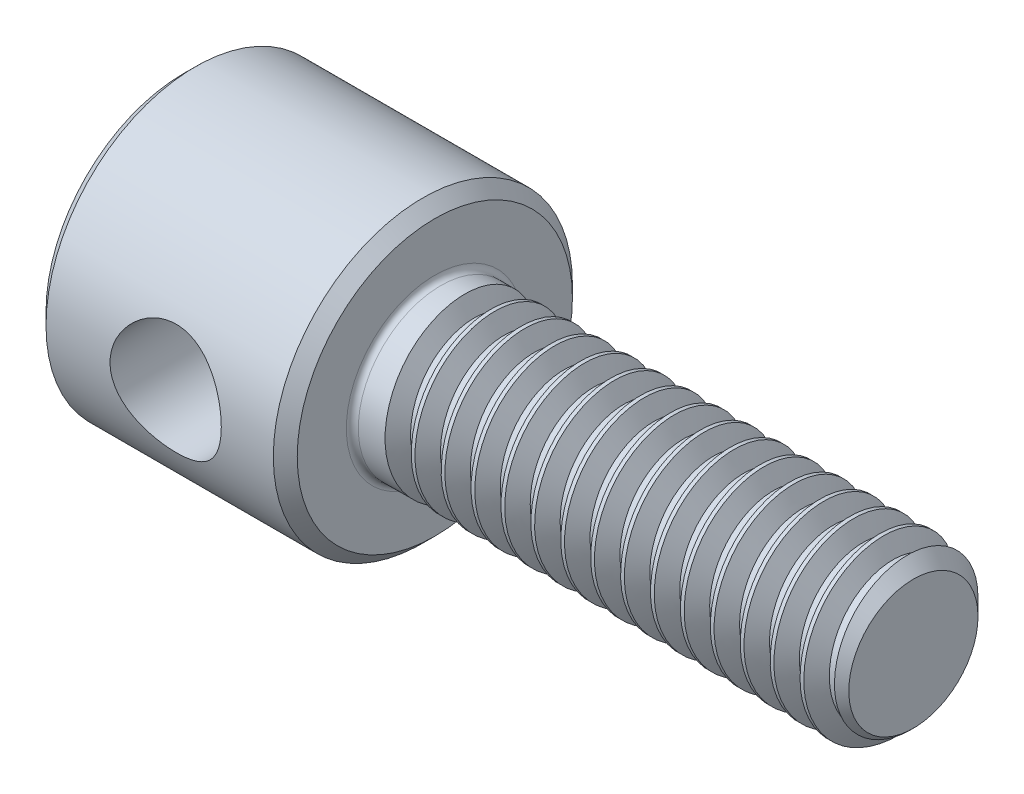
SolidWorks part; units mm, degrees
ref_plane "Front Plane" through (0, 0, 0) normal (0, 0, 1) x (1, 0, 0)
ref_plane "Top Plane" through (0, 0, 0) normal (0, 1, 0) x (1, 0, 0)
ref_plane "Right Plane" through (0, 0, 0) normal (1, 0, 0) x (0, 0, -1)
sketch "Sketch1" plane through (0, 0, 0) normal (0, 0, 1) x (1, 0, 0)
  line L0 (0, 3.8334) -> (0, 0) construction
  line L1 (0, 0) -> (-7.2131, 0) construction
  line L2 (0, 0) -> (13.7381, 0) construction
  line L3 (-5.334, 0) -> (-5.334, 2.921)
  line L4 (-5.08, 3.175) -> (-0.254, 3.175)
  line L5 (0, 2.921) -> (0, 1.8796)
  line L6 (0.127, 1.7526) -> (9.779, 1.7526)
  line L7 (10.16, 1.3716) -> (10.16, 0)
  line L8 (10.16, 0) -> (-5.334, 0)
  line L9 (-5.334, 2.921) -> (-5.08, 3.175)
  line L10 (-0.254, 3.175) -> (0, 2.921)
  line L11 (9.779, 1.7526) -> (10.16, 1.3716)
  arc A0 (0.127, 1.7526) -> (0, 1.8796) centre (0.127, 1.8796) cw
  point P7 (-5.334, 3.175)
  point P8 (0, 3.175)
  point P10 (10.16, 1.7526)
  point P19 (0, 1.7526)
  dimension "D5" = 0.127
  dimension "D1" = 6.35
  dimension "D2" = 3.5052
  dimension "D3" = 5.334
  dimension "D4" = 10.16
revolve "Revolve1" add sketch "Sketch1" angle 360 about L1
thread "Thread1" pitch 0.635 start angle 0, offset 1, length 10, pitch 0.635, diameter 3.5052
ref_plane "Plane1" through (10.779, 0, 1.7526) normal (0, -1, 0) x (0, 0, 1)
sketch "Thread Profile1" plane through (10.779, 0, 1.7526) normal (0, -1, 0) x (0, 0, 1)
  line L0 (0, 0) -> (0, 0.635) construction
  line L11 (0, 0) -> (0, 0.5556)
  line L12 (0, 0.5556) -> (-0.3437, 0.3572)
  line L13 (-0.3437, 0.3572) -> (-0.3437, 0.1984)
  line L15 (-0.3437, 0.1984) -> (0, 0)
  line L17 (-0.3437, 0.2778) -> (0, 0.2778) construction
  point P2 (0, 0)
  dimension "Pitch" = 0.635
  dimension "Profile_Angle" = 60
  dimension "Profile_Land" = 0.1588
  dimension "Profile_Height" = 0.3437
sketch "Sketch5" plane through (0, 0, 0) normal (0, 0.0124, -0.9999) x (-1, 0, 0)
  line L4 (-0.5806, -1.4089) -> (-0.7791, -1.7526)
  line L5 (-0.7791, -1.7526) -> (-0.2234, -1.7526)
  line L6 (-0.2234, -1.7526) -> (-0.4219, -1.4089)
  line L7 (-0.4219, -1.4089) -> (-0.5806, -1.4089)
  line L8 (-0.5806, -1.4089) -> (-0.7791, -1.7526)
  line L9 (-0.7791, -1.7526) -> (-0.2234, -1.7526)
  line L10 (-0.2234, -1.7526) -> (-0.4219, -1.4089)
  line L11 (-0.4219, -1.4089) -> (-0.5806, -1.4089)
  dimension "D1" = 0
extrude "Cut-Extrude1" cut sketch "Sketch5" against normal up to surface (0 mm away)
sketch "Sketch6" plane through (0, 0, 0) normal (0, 0, 1) x (1, 0, 0)
  line L0 (0, 0) -> (-2.54, 0) construction
  circle A0 centre (-2.54, 0) radius 1.1811
  dimension "D1" = 2.3622
  dimension "D2" = 2.54
extrude "Cut-Extrude2" cut sketch "Sketch6" against normal through all both and the other way through all
